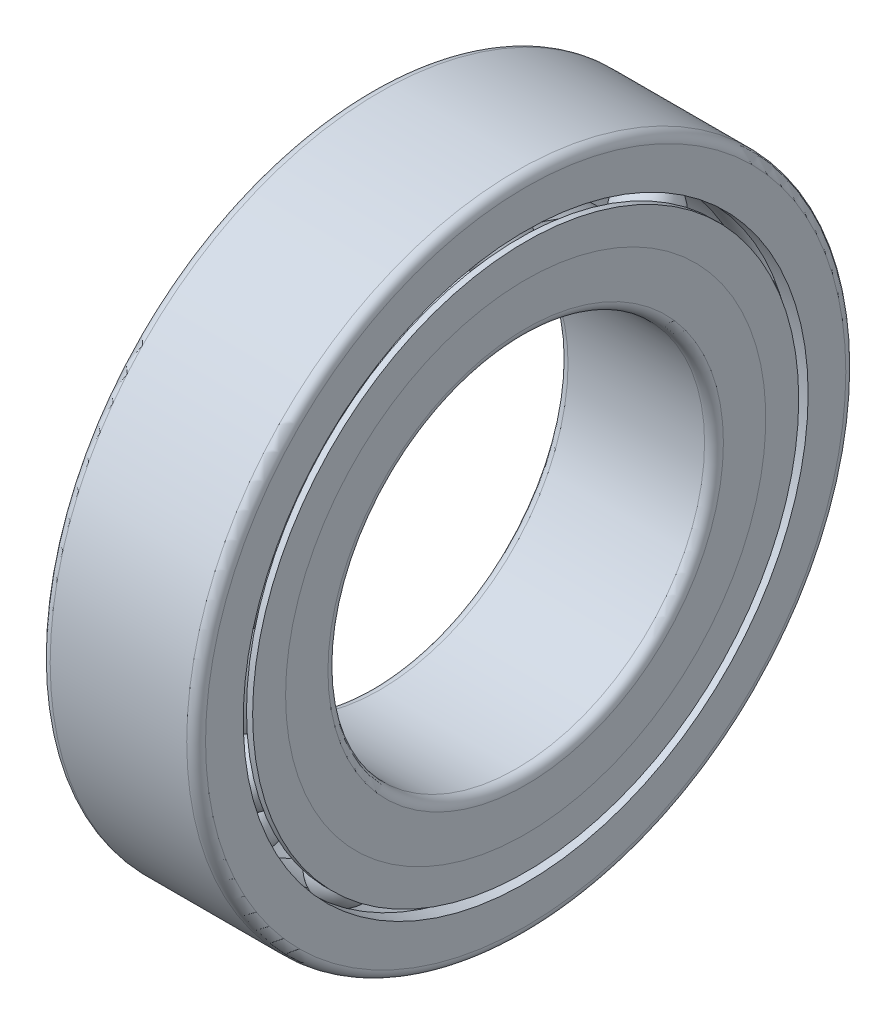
SolidWorks part; units mm, degrees
ref_plane "Plan de face" through (0, 0, 0) normal (0, 0, 1) x (1, 0, 0)
ref_plane "Plan de dessus" through (0, 0, 0) normal (0, 1, 0) x (1, 0, 0)
ref_plane "Plan de droite" through (0, 0, 0) normal (1, 0, 0) x (0, 0, -1)
sketch "Esquisse1" plane through (0, 0, 0) normal (0, 0, 1) x (1, 0, 0)
  line L0 (-16.5, 51) -> (-16.5, 42)
  line L1 (-14.5, 40) -> (14.5, 40)
  line L2 (16.5, 42) -> (16.5, 51)
  line L3 (16.5, 51) -> (14.4721, 51)
  line L4 (5.5279, 51) -> (-5.5279, 51)
  line L5 (-14.4721, 51) -> (-16.5, 51)
  line L6 (23, 0) -> (0, 0) construction
  line L7 (0, 31.8165) -> (0, 12.6443) construction
  arc A0 (-16.5, 42) -> (-14.5, 40) centre (-14.5, 42) ccw
  arc A1 (14.5, 40) -> (16.5, 42) centre (14.5, 42) ccw
  arc A2 (14.4721, 51) -> (5.5279, 51) centre (10, 55) cw
  arc A3 (-5.5279, 51) -> (-14.4721, 51) centre (-10, 55) cw
  dimension "D4" = 2
  dimension "D5" = 6
  dimension "D1" = 33
  dimension "D2" = 102
  dimension "D3" = 80
  dimension "D6" = 4
  dimension "D7" = 20
revolve "Révolution1" add sketch "Esquisse1" angle 360 about L6
sketch "Esquisse2" plane through (0, 0, 0) normal (0, 0, 1) x (1, 0, 0)
  line L0 (-16.5, 68) -> (-16.5, 60)
  line L1 (-16.5, 60) -> (-13.2688, 60)
  line L2 (-6.7312, 60) -> (6.6834, 60)
  line L3 (13.3166, 60) -> (16.5, 60)
  line L4 (16.5, 60) -> (16.5, 68)
  line L5 (14.5, 70) -> (-14.5, 70)
  line L6 (23, 0) -> (0, 0) construction
  line L7 (16.5, 44.8242) -> (16.5, 20.9635) construction
  line L8 (-16.5, 51) -> (-16.5, -51) construction
  arc A0 (-13.2688, 60) -> (-6.7312, 60) centre (-10, 54.9686) cw
  arc A1 (6.6834, 60) -> (13.3166, 60) centre (10, 55) cw
  arc A2 (16.5, 68) -> (14.5, 70) centre (14.5, 68) ccw
  arc A3 (-14.5, 70) -> (-16.5, 68) centre (-14.5, 68) ccw
  dimension "D2" = 2
  dimension "D4" = 5.0314
  dimension "D5" = 6
  dimension "D1" = 33
  dimension "D3" = 20
  dimension "D6" = 140
  dimension "D7" = 120
revolve "Révolution2" add sketch "Esquisse2" angle 360 about L6
sketch "Esquisse3" plane through (0, 0, 0) normal (0, 0, 1) x (1, 0, 0)
  line L0 (-11.9489, 55) -> (37.6805, 55) construction
  line L1 (-16, 55) -> (-4, 55)
  line L2 (4, 55) -> (16, 55)
  arc A0 (4, 55) -> (16, 55) centre (10, 55) ccw
  arc A1 (-16, 55) -> (-4, 55) centre (-10, 55) ccw
revolve "Révolution3" add sketch "Esquisse3" angle 360 about L0
sketch "Esquisse4" plane through (0, 0, 0) normal (0, 0, 1) x (1, 0, 0)
  line L0 (-16.5, 58) -> (-16.5, 51)
  line L1 (-16.5, 51) -> (-14.4721, 51)
  line L2 (-15.1962, 58) -> (-16.5, 58)
  line L3 (-16.5, 68) -> (-16.5, -68) construction
  line L4 (-16.5, 51) -> (-16.5, -51) construction
  line L5 (-14.4721, 51) -> (-16.5, 51) construction
  line L6 (0, 0) -> (45.0992, 0) construction
  arc A0 (-14.4721, 51) -> (-15.1962, 58) centre (-10, 55) cw
  dimension "D4" = 6
  dimension "D1" = 7
revolve "Révolution4" add sketch "Esquisse4" angle 360 about L6
pattern_circular "Répétition circulaire1" count 10 over 360 about axis through (0, 0, 0) along (1, 0, 0)
mirror "Symétrie1" about plane through (0, 0, 0) normal (1, 0, 0)
sketch "Esquisse6" plane through (-16.5, 0, 0) normal (-1, 0, 0) x (0, 0, 1)
  line L1 (0, 73.7171) -> (76.3722, 73.7171)
  line L2 (0, 73.7171) -> (0, -76.216)
  line L3 (0, -76.216) -> (76.3722, -76.216)
  line L4 (76.3722, 73.7171) -> (76.3722, -76.216)
extrude "Enlèv. mat.-Extru.1" [suppressed] cut sketch "Esquisse6" against normal through all
